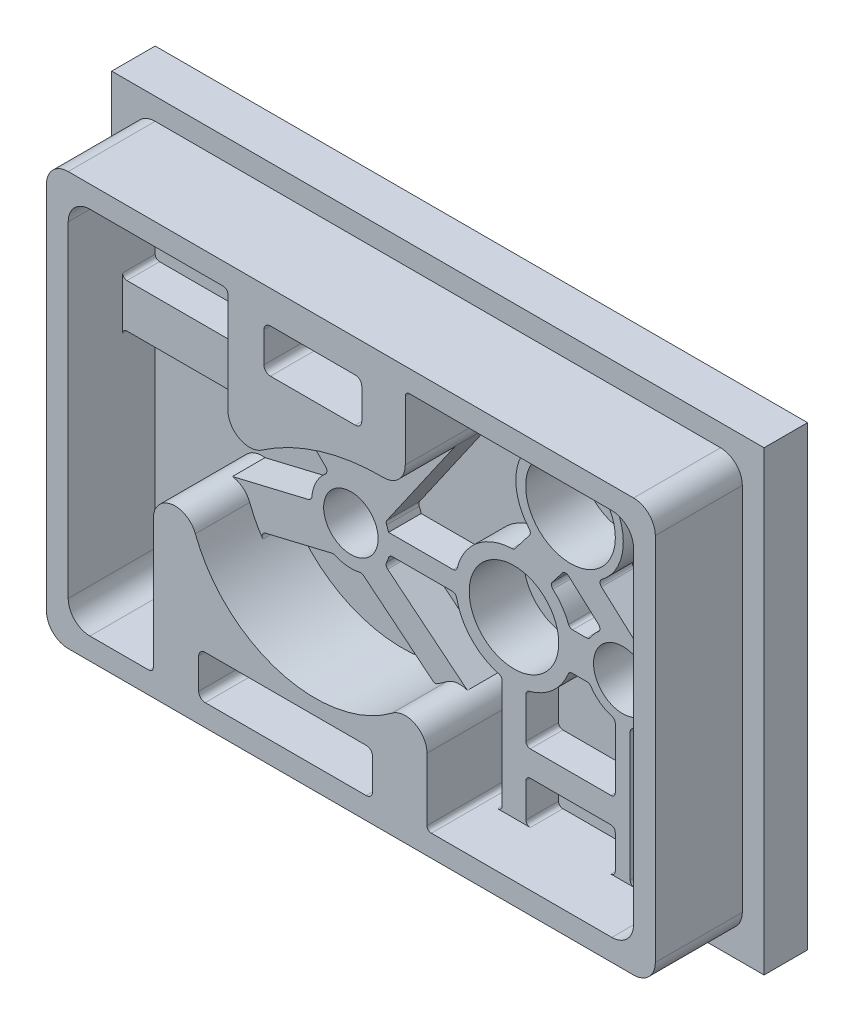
SolidWorks part; units mm, degrees
ref_plane "Plane1" through (0, 0, 0) normal (0, 0, 1) x (1, 0, 0)
ref_plane "Plane2" through (0, 0, 0) normal (0, 1, 0) x (1, 0, 0)
ref_plane "Plane3" through (0, 0, 0) normal (1, 0, 0) x (0, 0, -1)
sketch "Sketch1" plane through (0, 0, 0) normal (0, 0, 1) x (1, 0, 0)
  line L0 (-150, 100) -> (150, 100)
  line L1 (-150, 100) -> (-150, -110)
  line L2 (150, -110) -> (-150, -110)
  line L3 (150, -110) -> (150, 100)
extrude "Base-Extrude" add sketch "Sketch1" against normal blind 20
sketch "Sketch2" plane through (0, 0, 0) normal (0, 0, 1) x (1, 0, 0)
  line L0 (-130, 90) -> (130, 90)
  line L1 (-140, 80) -> (-140, -90)
  line L2 (130, -100) -> (-130, -100)
  line L3 (140, -90) -> (140, 80)
  arc A0 (140, 80) -> (130, 90) centre (130, 80) ccw
  arc A1 (140, -90) -> (130, -100) centre (130, -90) cw
  arc A2 (-140, -90) -> (-130, -100) centre (-130, -90) ccw
  arc A3 (-130, 90) -> (-140, 80) centre (-130, 80) ccw
extrude "Boss-Extrude1" add sketch "Sketch2" along normal blind 70
sketch "Sketch3" plane through (0, 0, 70) normal (0, 0, 1) x (1, 0, 0)
  line L0 (-120, 80) -> (120, 80)
  line L1 (-130, 70) -> (-130, -80)
  line L2 (120, -90) -> (-120, -90)
  line L3 (130, -80) -> (130, 70)
  arc A0 (-120, 80) -> (-130, 70) centre (-120, 70) ccw
  arc A1 (130, 70) -> (120, 80) centre (120, 70) ccw
  arc A2 (120, -90) -> (130, -80) centre (120, -80) ccw
  arc A3 (-130, -80) -> (-120, -90) centre (-120, -80) ccw
extrude "Cut-Extrude1" cut sketch "Sketch3" against normal blind 70
sketch "Sketch4" plane through (0, 0, 0) normal (0, 0, 1) x (1, 0, 0)
  line L0 (-56.5851, 80) -> (25, 80)
  line L1 (-56.5851, 80) -> (-56.5851, 31.8614)
  line L2 (-90.8719, -90) -> (-90.8719, -28.5838)
  line L3 (25, 50.6236) -> (25, 80)
  line L4 (-120, 80) -> (120, 80) construction
  line L5 (120, -90) -> (-120, -90) construction
  line L7 (35, -59.1691) -> (35, -90)
  line L8 (-90.8719, -90) -> (35, -90)
  arc A0 (-40.93, 23.614) -> (14.9039, 40.624) centre (13.971, -56.4539) cw
  arc A1 (-56.5851, 31.8614) -> (-40.93, 23.614) centre (-46.5851, 31.8614) ccw
  arc A2 (25, 50.6236) -> (14.9039, 40.624) centre (15, 50.6236) cw
  arc A3 (-71.5286, -25.0197) -> (18.9968, -51.1715) centre (-16.4148, -3.9957) ccw
  arc A4 (35, -59.1691) -> (18.9968, -51.1715) centre (25, -59.1691) ccw
  arc A5 (-90.8719, -28.5838) -> (-71.5286, -25.0197) centre (-80.8719, -28.5838) cw
extrude "Boss-Extrude2" add sketch "Sketch4" along normal blind 70
sketch "Sketch5" plane through (0, 0, 70) normal (0, 0, 1) x (1, 0, 0)
  line L0 (-37, 75) -> (2, 75)
  line L1 (-40, 72) -> (-40, 58)
  line L2 (2, 55) -> (-37, 55)
  line L3 (5, 58) -> (5, 72)
  line L4 (-67, -70) -> (7, -70)
  line L5 (-70, -73) -> (-70, -87)
  line L6 (7, -90) -> (-67, -90)
  line L7 (10, -87) -> (10, -73)
  arc A0 (10, -73) -> (7, -70) centre (7, -73) ccw
  arc A1 (10, -87) -> (7, -90) centre (7, -87) cw
  arc A2 (-70, -87) -> (-67, -90) centre (-67, -87) ccw
  arc A3 (-67, -70) -> (-70, -73) centre (-67, -73) ccw
  arc A4 (5, 58) -> (2, 55) centre (2, 58) cw
  arc A5 (2, 75) -> (5, 72) centre (2, 72) cw
  arc A6 (-40, 72) -> (-37, 75) centre (-37, 72) cw
  arc A7 (-40, 58) -> (-37, 55) centre (-37, 58) ccw
extrude "Cut-Extrude2" cut sketch "Sketch5" against normal blind 70
sketch "Sketch6" plane through (0, 0, 0) normal (0, 0, 1) x (1, 0, 0)
  line L0 (-130, 35.1059) -> (-56.5851, 35.1059)
  line L1 (-130, 70) -> (-130, -80) construction
  line L2 (-56.5851, 80) -> (-56.5851, 31.8614) construction
  line L3 (-130, 15) -> (-45, 15)
  line L4 (-45, 15) -> (-35, 5)
  line L5 (-20.1623, 15.1059) -> (-40.1623, 35.1059)
  line L6 (-20.1623, 15.1059) -> (-0.1623, 40.1059)
  line L7 (23.3743, 45.1582) -> (-9.0795, -1.5421)
  line L8 (-43.0278, -10) -> (-79.7377, -18.7462)
  line L9 (-67.0557, -34.2985) -> (-32.9602, -26.1752)
  line L10 (-20, -27.3205) -> (13.4855, -54.6452)
  line L11 (28.5818, -49.8326) -> (-9.3232, -18.9015)
  line L12 (75.5629, -1.5421) -> (84.5011, -1.5421)
  line L13 (-7.6705, -5.0313) -> (23.5366, -5.0313)
  line L14 (-7.3816, -13.82) -> (23.3465, -13.82)
  line L15 (75.4119, -18.9015) -> (84.7516, -18.9015)
  line L16 (116.943, -5.0313) -> (130, -5)
  line L17 (130, -80) -> (130, 70) construction
  line L18 (116.943, -14.9687) -> (130, -14.9687)
  line L19 (-56.5851, 35.1059) -> (-40.1623, 35.1059)
  line L20 (-0.1623, 40.1059) -> (23.3743, 45.1582)
  line L21 (-79.7377, -18.7462) -> (-67.0557, -34.2985)
  line L22 (13.4855, -54.6452) -> (28.5818, -49.8326)
  line L23 (70, 80) -> (70, 69.1267)
  line L24 (25, 80) -> (120, 80) construction
  line L25 (80, 80) -> (80, 69.3594)
  line L26 (50, 16.9258) -> (58.1406, 27.5313)
  line L27 (66.4756, 11.2968) -> (73.5386, 20.4266)
  line L28 (73.5386, 20.4266) -> (90.6859, 5)
  line L29 (109.3141, 5) -> (88.3173, 23.8898)
  line L30 (96.5718, -27.3205) -> (96.5718, -58.6603)
  line L31 (120, -90) -> (35, -90) construction
  line L32 (103.4282, -27.3205) -> (103.4282, -90)
  line L33 (44.5063, -36.3594) -> (44.5063, -90)
  line L34 (55.4937, -36.3594) -> (55.4937, -58.6616)
  line L35 (55.4937, -58.6616) -> (96.5718, -58.6603)
  line L36 (55.4937, -70.3696) -> (96.5718, -70.3696)
  line L37 (96.5718, -70.3696) -> (96.5718, -90)
  line L38 (55.4937, -70.3696) -> (55.4937, -90)
  line L39 (70, 80) -> (80, 80)
  line L40 (130, -5) -> (130, -14.9687)
  line L41 (96.5718, -90) -> (103.4282, -90)
  line L42 (44.5063, -90) -> (55.4937, -90)
  line L43 (-130, 35.1059) -> (-130, 15)
  arc A0 (-7.6705, -5.0313) -> (-9.0795, -1.5421) centre (-25, -10) ccw
  arc A1 (75.5629, -1.5421) -> (66.4756, 11.2968) centre (50, -10) ccw
  arc A2 (116.943, -5.0313) -> (109.3141, 5) centre (100, -10) ccw
  arc A3 (84.7516, -18.9015) -> (96.5718, -27.3205) centre (100, -10) ccw
  arc A4 (23.3465, -13.82) -> (44.5063, -36.3594) centre (50, -10) ccw
  arc A5 (-32.9602, -26.1752) -> (-20, -27.3205) centre (-25, -10) ccw
  arc A6 (-9.3232, -18.9015) -> (-7.3816, -13.82) centre (-25, -10) ccw
  arc A7 (-35, 5) -> (-43.0278, -10) centre (-25, -10) ccw
  arc A8 (70, 69.1267) -> (58.1406, 27.5313) centre (75.5629, 45.0523) ccw
  arc A9 (50, 16.9258) -> (23.5366, -5.0313) centre (50, -10) ccw
  arc A10 (88.3173, 23.8898) -> (80, 69.3594) centre (75.5629, 45.0523) ccw
  arc A11 (90.6859, 5) -> (84.5011, -1.5421) centre (100, -10) ccw
  arc A12 (55.4937, -36.3594) -> (75.4119, -18.9015) centre (50, -10) ccw
  arc A13 (103.4282, -27.3205) -> (116.943, -14.9687) centre (100, -10) ccw
  arc A14 (35, -59.1691) -> (18.9968, -51.1715) centre (25, -59.1691) ccw construction
  arc A15 (35, -59.1691) -> (18.9968, -51.1715) centre (25, -59.1691) ccw construction
  arc A16 (14.9039, 40.624) -> (25, 50.6236) centre (15, 50.6236) ccw construction
  arc A17 (14.9039, 40.624) -> (25, 50.6236) centre (15, 50.6236) ccw construction
extrude "Boss-Extrude3" add sketch "Sketch6" along normal blind 15
sketch "Sketch7" plane through (0, 0, 15) normal (0, 0, 1) x (1, 0, 0)
  circle A0 centre (76, 45) radius 20.6155
  circle A1 centre (100, -10) radius 13.4164
  circle A2 centre (50, -10) radius 20.5913
  circle A3 centre (-25, -10) radius 12.53
extrude "Cut-Extrude3" cut sketch "Sketch7" against normal blind 25
ref_plane "Plane4" through (0, 0, 40) normal (0, 0, 1) x (1, 0, 0)
sketch "Sketch8" plane through (0, 0, 40) normal (0, 0, 1) x (1, 0, 0)
  line L0 (-170, -145) -> (140, -145)
  line L1 (-170, -145) -> (-170, 192)
  line L2 (140, 192) -> (-170, 192)
  line L3 (140, 192) -> (140, -145)
extrude "Cut-Extrude4" cut sketch "Sketch8" along normal through all
fillet "Fillet1" radius 2 1 edges at (-45, 15, 7.5)
fillet "Fillet2" radius 2 1 edges at (-35, 5, 7.5)
fillet "Fillet3" radius 2 1 edges at (-43.0278, -10, 7.5)
fillet "Fillet4" radius 2 4 edges at (-67.0278, -34.2919, 7.5) (-32.9602, -26.1752, 7.5) (-20, -27.3205, 7.5) (-7.3816, -13.82, 7.5)
fillet "Fillet5" radius 2 2 edges at (55.4937, -36.3594, 7.5) (66.4756, 11.2968, 7.5)
fillet "Fillet6" radius 2 1 edges at (-33.3635, 28.3072, 7.5)
fillet "Fillet7" radius 2 2 edges at (-9.3232, -18.9015, 7.5) (-9.0795, -1.5421, 7.5)
fillet "Fillet8" radius 2 1 edges at (-0.6272, 39.5247, 7.5)
fillet "Fillet9" radius 2 4 edges at (23.3465, -13.82, 7.5) (44.5063, -36.3594, 7.5) (70, 69.1267, 7.5) (58.1406, 27.5313, 7.5)
fillet "Fillet10" radius 2 1 edges at (23.5366, -5.0313, 7.5)
fillet "Fillet11" radius 2 1 edges at (50, 16.9258, 7.5)
fillet "Fillet12" radius 2 5 edges at (-56.5851, 35.1059, 7.5) (13.8414, -54.5317, 15) (13.4855, -54.6452, 7.5) (13.8414, -54.5317, 0) (96.5718, -58.6603, 7.5)
fillet "Fillet15" radius 2 2 edges at (75.5629, -1.5421, 7.5) (84.5011, -1.5421, 7.5)
fillet "Fillet16" radius 2 1 edges at (88.3173, 23.8898, 7.5)
fillet "Fillet17" radius 2 4 edges at (55.4937, -90, 7.5) (55.4937, -70.3696, 7.5) (96.5718, -70.3696, 7.5) (96.5718, -90, 7.5)
fillet "Fillet18" radius 2 4 edges at (103.4282, -27.3205, 7.5) (116.943, -5.0313, 7.5) (109.3141, 5, 7.5) (75.4119, -18.9015, 7.5)
fillet "Fillet19" radius 2 2 edges at (84.7516, -18.9015, 7.5) (96.5718, -27.3205, 7.5)
fillet "Fillet20" radius 2 1 edges at (116.943, -14.9687, 7.5)
fillet "Fillet21" radius 2 1 edges at (73.5386, 20.4266, 7.5)
fillet "Fillet22" radius 2 1 edges at (90.6859, 5, 7.5)
fillet "Fillet23" radius 2 1 edges at (130, -5, 7.5)
fillet "Fillet24" radius 2 1 edges at (55.4937, -58.6616, 7.5)
fillet "Fillet25" radius 2 1 edges at (35, -90, 20)
fillet "Fillet26" radius 2 1 edges at (80, 69.3594, 7.5)
fillet "Fillet27" radius 2 1 edges at (70, 80, 7.5)
fillet "Fillet28" radius 2 1 edges at (80, 80, 7.5)
fillet "Fillet29" radius 2 1 edges at (-130, 15, 7.5)
fillet "Fillet30" radius 2 1 edges at (-130, 35.1059, 7.5)
fillet "Fillet31" radius 2 1 edges at (-56.5851, 80, 20)
fillet "Fillet32" radius 2 1 edges at (-20.1623, 15.1059, 7.5)
fillet "Fillet33" radius 2 1 edges at (-90.8719, -90, 20)
fillet "Fillet34" radius 2 1 edges at (25, 80, 20)
fillet "Fillet35" radius 2 1 edges at (44.5063, -90, 7.5)
fillet "Fillet36" radius 2 1 edges at (103.4282, -90, 7.5)
fillet "Fillet37" radius 2 1 edges at (130, -14.9687, 7.5)
